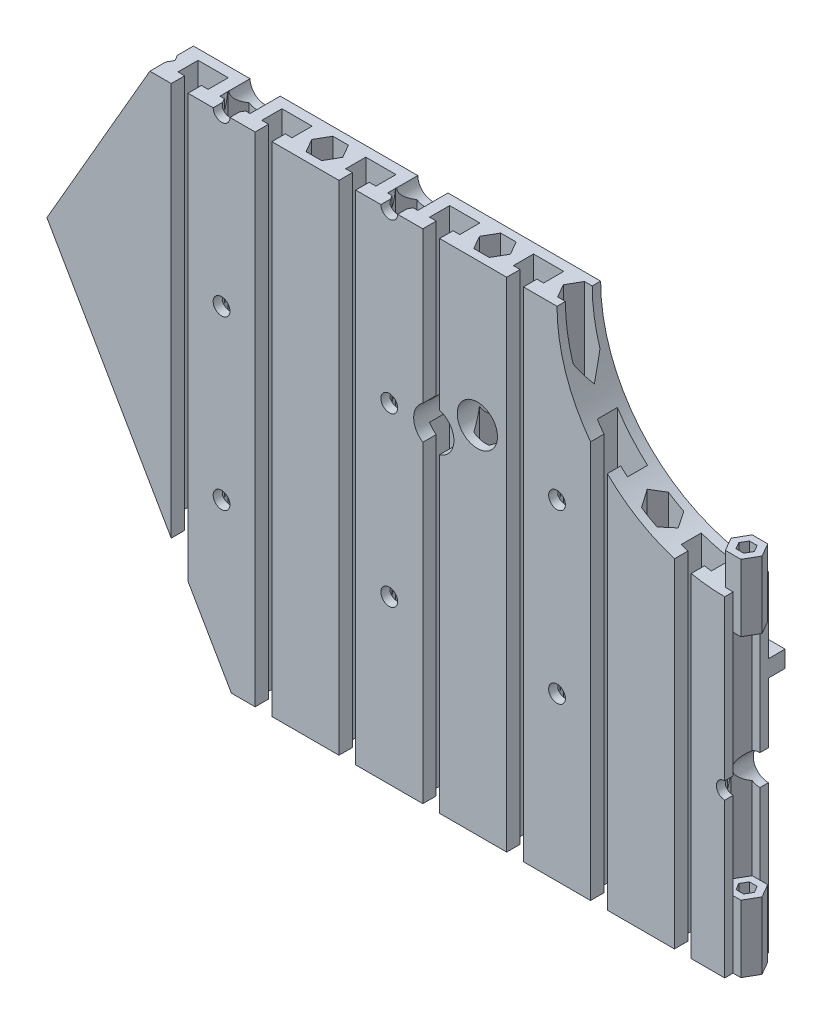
SolidWorks part; units mm, degrees
ref_plane "Plan de face" through (0, 0, 0) normal (0, 0, 1) x (1, 0, 0)
ref_plane "Plan de dessus" through (0, 0, 0) normal (0, 1, 0) x (1, 0, 0)
ref_plane "Plan de droite" through (0, 0, 0) normal (1, 0, 0) x (0, 0, -1)
sketch "Esquisse1" plane through (0, 0, 0) normal (0, 0, 1) x (1, 0, 0)
  line L6 (35.7636, 358.7862) -> (-423.8647, -437.3133) construction
  line L7 (-755.4678, -148.4209) -> (879.7592, -148.4209) construction
  line L8 (-46.1325, 376.7457) -> (415.4529, -422.7436) construction
  line L9 (257.0726, -148.4209) -> (-245.0999, 141.5085) construction
  line L10 (-257.0726, -148.4209) -> (263.2247, 151.9729) construction
  line L11 (-55, 201.5791) -> (55, 201.5791)
  line L12 (-147.0726, -148.4209) -> (147.0726, -148.4209)
  line L13 (147.0726, -148.4209) -> (202.0726, -53.1581)
  line L14 (202.0726, -53.1581) -> (55, 201.5791)
  line L15 (-147.0726, -148.4209) -> (-202.0726, -53.1581)
  line L16 (-202.0726, -53.1581) -> (-55, 201.5791)
  dimension "D1" = 60
  dimension "D2" = 60
  dimension "D3" = 110
  dimension "D4" = 350
  dimension "D5" = 60
  dimension "D6" = 60
  dimension "D7" = 110
  dimension "D8" = 110
extrude "Boss.-Extru.2" add sketch "Esquisse1" along normal blind 13
sketch "Esquisse3" plane through (0, 201.5791, 0) normal (0, 1, 0) x (1, 0, 0)
  line L0 (-12.5, 6.793) -> (-12.5, -19.2478) construction
  line L1 (-8, -3) -> (-17, -3)
  line L2 (-17, -3) -> (-17, -9)
  line L3 (-17, -9) -> (-15, -9)
  line L4 (-15, -9) -> (-15, -13)
  line L5 (55, -13) -> (-55, -13) construction
  line L6 (-10, -9) -> (-10, -13)
  line L7 (-8, -9) -> (-10, -9)
  line L8 (-8, -3) -> (-8, -9)
  line L9 (-15, -13) -> (-10, -13)
  point P2 (-12.5, -13)
  point P14 (-12.5, -3)
  dimension "D1" = 12.5
  dimension "D2" = 9
  dimension "D3" = 5
  dimension "D4" = 6
  dimension "D5" = 4
extrude "Enlèv. mat.-Extru.1" cut sketch "Esquisse3" against normal up to next
pattern_linear "Répétition linéaire1" count 8 spacing 25 along (1, 0, 0) of "Enlèv. mat.-Extru.1"
pattern_linear "Répétition linéaire2" count 7 spacing 25 along (-1, 0, 0) of "Enlèv. mat.-Extru.1"
sketch "certcleRotules" plane through (0, 0, 13) normal (0, 0, 1) x (1, 0, 0)
  circle A0 centre (0, 0) radius 157.5
  dimension "D1" = 315
sketch "Esquisse6" plane through (0, 0, 0) normal (0, 1, 0) x (1, 0, 0)
  line L0 (-157.5, -13) -> (157.5, -13) construction
  line L1 (0, 0) -> (-4.5, 0)
  line L2 (0, 0) -> (0, -13)
  line L3 (-2.5, -9) -> (-4.5, -9)
  line L4 (-4.5, 0) -> (-4.5, -9)
  line L7 (0, -13) -> (-2.5, -13)
  line L8 (-2.5, -9) -> (-2.5, -13)
  dimension "D1" = 4.5
  dimension "D2" = 2.5
  dimension "D3" = 4
revolve "Enlèvement de matière-Révolution1" cut sketch "Esquisse6" angle 360 about L2
pattern_linear "Répétition linéaire3" count 4 spacing 50 along (0, 1, 0) count 4 spacing 50 along (1, 0, 0) of "Enlèvement de matière-Révolution1"
pattern_linear "Répétition linéaire5" count 3 spacing 50 along (0, -1, 0) count 4 spacing 50 along (1, 0, 0) of "Enlèvement de matière-Révolution1"
pattern_linear "Répétition linéaire6" count 4 spacing 50 along (0, 1, 0) count 4 spacing 50 along (-1, 0, 0) of "Enlèvement de matière-Révolution1"
pattern_linear "Répétition linéaire7" count 3 spacing 50 along (0, -1, 0) count 4 spacing 50 along (-1, 0, 0) of "Enlèvement de matière-Révolution1"
sketch "Esquisse8" plane through (0, 0, 0) normal (0, 0, -1) x (-1, 0, 0)
  circle A0 centre (0, 100) radius 4.5 construction
  circle A1 centre (0, 100) radius 4.5
extrude "bouchonBarreauHaut" add sketch "Esquisse8" against normal blind 13
sketch "Esquisse7" plane through (0, 0, 0) normal (0, 0, -1) x (-1, 0, 0)
  line L1 (-6.5, 105.15) -> (6.5, 105.15)
  line L2 (-6.5, 105.15) -> (-6.5, 80.15)
  line L3 (-6.5, 80.15) -> (6.5, 80.15)
  line L4 (6.5, 105.15) -> (6.5, 80.15)
  line L5 (0, 7.15) -> (0, -7.15) construction
  dimension "D1" = 25
  dimension "D2" = 80.15
  dimension "D3" = 13
  dimension "D4" = 6.5
extrude "Boss.-Extru.4" add sketch "Esquisse7" along normal blind 5
sketch "4parties" plane through (0, 0, 0) normal (0, 0, 1) x (1, 0, 0)
  line L0 (-25, 201.5791) -> (-25, 43.3013)
  line L1 (-55, 201.5791) -> (55, 201.5791) construction
  line L2 (-50, 0) -> (-171.3817, 0)
  line L3 (-165, 11.0535) -> (-202.0726, -53.1581) construction
  line L4 (50, 0) -> (171.3817, 0)
  line L5 (202.0726, -53.1581) -> (165, 11.0535) construction
  line L6 (0, -50) -> (0, -148.4209)
  line L7 (-10, -148.4209) -> (10, -148.4209) construction
  circle A0 centre (0, 0) radius 50
  dimension "D1" = 100
  dimension "D2" = 10
sketch "Esquisse9" plane through (0, 0, 0) normal (1, 0, 0) x (0, 0, -1)
  line L0 (5, 80.15) -> (0, 80.15) construction
  line L1 (5, 80.15) -> (5, 105.15) construction
  line L3 (5, 85.15) -> (5, 82.5)
  line L4 (5, 82.5) -> (-3, 82.5)
  line L6 (-3, -148.4209) -> (-3, 201.5791) construction
  line L7 (-13, 157.5) -> (-13, -157.5) construction
  line L8 (-3, 79.15) -> (-13, 79.15)
  line L9 (-3, 79.15) -> (-3, 82.5)
  line L10 (5, 85.15) -> (-13, 85.15)
  line L11 (-13, 79.15) -> (-13, 85.15)
  dimension "D1" = 5
  dimension "D2" = 2.65
  dimension "D3" = 6
revolve "Enlèvement de matière-Révolution2" cut sketch "Esquisse9" angle 360 about L10
pattern_linear "Répétition linéaire8" count 2 spacing 15 along (0, 1, 0) of "Enlèvement de matière-Révolution2"
pattern_circular "Répétition circulaire1" count 3 every 120 about axis through (0, 0, 0) along (0, 0, 1) of "Boss.-Extru.4", "Enlèvement de matière-Révolution2", "Répétition linéaire8"
sketch "Esquisse10" plane through (0, 0, 0) normal (1, 0, 0) x (0, 0, -1)
  line L0 (0, 201.5791) -> (0, -53.1581) construction
  line L1 (0, 77.5) -> (5, 77.5)
  line L2 (0, 77.5) -> (0, 72.5)
  line L3 (0, 72.5) -> (5, 72.5)
  line L4 (5, 77.5) -> (5, 72.5)
  line L5 (0, 50) -> (0, -50) construction
  line L6 (0, -72.5) -> (5, -72.5)
  line L7 (0, -72.5) -> (0, -77.5)
  line L8 (0, -77.5) -> (5, -77.5)
  line L9 (5, -72.5) -> (5, -77.5)
  line L10 (5, 80.15) -> (5, 105.15) construction
  line L11 (-9, 50) -> (0, 50) construction
  line L13 (-9, -100) -> (0, -100) construction
  point P16 (2.5, 72.5)
  point P19 (2.5, -72.5)
  dimension "D1" = 22.5
  dimension "D2" = 5
  dimension "D3" = 22.5
  dimension "D4" = 5
extrude "Boss.-Extru.6" add sketch "Esquisse10" along normal mid plane 250
chamfer "Chanfrein1" distance 5 angle 60 4 edges at (125, -75, -5) (-125, -75, -5) (-125, 75, -5) (125, 75, -5)
sketch "Esquisse11" plane through (0, 0, 13) normal (0, 0, 1) x (1, 0, 0)
  line L0 (-10, -148.4209) -> (-10, 201.5791) construction
  line L1 (-10, 23.5) -> (10, 23.5)
  line L2 (-10, 23.5) -> (-10, -23.5)
  line L3 (-10, -23.5) -> (10, -23.5)
  line L4 (10, 23.5) -> (10, -23.5)
  line L5 (10, -148.4209) -> (10, 201.5791) construction
  dimension "D1" = 47
  dimension "D2" = 23.5
extrude "Enlèv. mat.-Extru.2" cut sketch "Esquisse11" against normal blind 8.9
sketch "Esquisse13" plane through (-8, 0, 0) normal (-1, 0, 0) x (0, 0, 1)
  line L1 (4.1, -23.5) -> (11.1, -23.5)
  line L2 (4.1, -23.5) -> (4.1, -40)
  line L3 (4.1, -40) -> (6.1, -40)
  line L4 (11.1, -23.5) -> (11.1, -35)
  arc A0 (6.1, -40) -> (11.1, -35) centre (6.1, -35) ccw
  dimension "D2" = 5
  dimension "D1" = 16.5
  dimension "D3" = 7
extrude "Enlèv. mat.-Extru.3" cut sketch "Esquisse13" against normal up to surface (16 mm away)
sketch "Esquisse14" plane through (0, 0, 4.1) normal (0, 0, 1) x (1, 0, 0)
  line L0 (-8, 23.5) -> (-8, -40) construction
  line L1 (-3, -20) -> (3, -20)
  line L2 (-8, -25) -> (-8, -35)
  line L3 (-3, -40) -> (3, -40)
  line L4 (8, -25) -> (8, -35)
  line L5 (8, -40) -> (8, 23.5) construction
  line L6 (8, -40) -> (-8, -40) construction
  arc A0 (-8, -35) -> (-3, -40) centre (-3, -35) ccw
  arc A1 (3, -40) -> (8, -35) centre (3, -35) ccw
  arc A2 (3, -20) -> (8, -25) centre (3, -25) cw
  arc A3 (-3, -20) -> (-8, -25) centre (-3, -25) ccw
  point P16 (8, -20)
  point P19 (-8, -20)
  dimension "D3" = 5
  dimension "D1" = 20
extrude "Enlèv. mat.-Extru.4" cut sketch "Esquisse14" against normal up to next
mirror "Symétrie1" about plane through (0, 0, 0) normal (0, 1, 0) of "Enlèv. mat.-Extru.4", "Enlèv. mat.-Extru.3"
sketch "Esquisse15" plane through (0, 0, 0) normal (0, 0, -1) x (-1, 0, 0)
  circle A0 centre (-50, 0) radius 4.5 construction
  circle A1 centre (0, -50) radius 4.5 construction
  circle A2 centre (50, 0) radius 4.5 construction
  circle A3 centre (0, 50) radius 4.5 construction
  circle A4 centre (-50, 0) radius 4.5
  circle A5 centre (0, -50) radius 4.5
  circle A6 centre (50, 0) radius 4.5
  circle A7 centre (0, 50) radius 4.5
extrude "boucheTrousCEntre" add sketch "Esquisse15" against normal up to surface (13 mm away)
sketch "Esquisse16" plane through (0, -148.4209, 0) normal (0, -1, 0) x (1, 0, 0)
  line L0 (0, -9.9) -> (0, 9.9) construction
  line L1 (-2.3094, 2.5) -> (2.3094, 2.5)
  line L2 (2.3094, 2.5) -> (4.6188, 6.5)
  line L3 (4.6188, 6.5) -> (2.3094, 10.5)
  line L4 (2.3094, 10.5) -> (-2.3094, 10.5)
  line L5 (-2.3094, 10.5) -> (-4.6188, 6.5)
  line L6 (-4.6188, 6.5) -> (-2.3094, 2.5)
  line L8 (-10, 13) -> (10, 13) construction
  circle A0 centre (0, 6.5) radius 4 construction
  dimension "D1" = 6.5
  dimension "D2" = 8
extrude "Enlèv. mat.-Extru.5" cut sketch "Esquisse16" against normal through all
pattern_linear "Répétition linéaire9" count 8 spacing 25 along (1, 0, 0) of "Enlèv. mat.-Extru.5"
pattern_linear "Répétition linéaire10" count 8 spacing 25 along (-1, 0, 0) of "Enlèv. mat.-Extru.5"
sketch "Esquisse17" plane through (0, 0, 0) normal (0, 0, -1) x (-1, 0, 0)
  line L0 (50, 0) -> (171.3817, 0) construction
  line L1 (50, 0) -> (171.3817, 0)
  line L2 (0, -50) -> (0, -148.4209) construction
  line L3 (0, -50) -> (0, -148.4209)
  line L6 (202.0726, -53.1581) -> (55, 201.5791)
  line L7 (55, 201.5791) -> (-55, 201.5791)
  line L8 (-55, 201.5791) -> (-202.0726, -53.1581)
  line L9 (-202.0726, -53.1581) -> (-147.0726, -148.4209)
  line L10 (-147.0726, -148.4209) -> (147.0726, -148.4209)
  line L11 (147.0726, -148.4209) -> (202.0726, -53.1581)
  line L12 (171.3817, 0) -> (55, 201.5791)
  line L13 (55, 201.5791) -> (-55, 201.5791)
  line L14 (-55, 201.5791) -> (-202.0726, -53.1581)
  line L15 (-202.0726, -53.1581) -> (-147.0726, -148.4209)
  line L16 (-147.0726, -148.4209) -> (0, -148.4209)
  circle A0 centre (0, 0) radius 50 construction
  arc A1 (0, -50) -> (50, 0) centre (0, 0) ccw
  dimension "D1" = 0
extrude "Enlèv. mat.-Extru.6" cut sketch "Esquisse17" against normal through all both and the other way through all
sketch "Esquisse20" plane through (0, -148.4209, 0) normal (0, -1, 0) x (1, 0, 0)
  line L0 (0, 9) -> (0, 6.7058) construction
  line L1 (-4.6188, 6.5) -> (-2.3094, 2.5)
  line L2 (-2.3094, 2.5) -> (2.3094, 2.5)
  line L3 (2.3094, 2.5) -> (4.6188, 6.5)
  line L4 (4.6188, 6.5) -> (2.3094, 10.5)
  line L5 (2.3094, 10.5) -> (-2.3094, 10.5)
  line L6 (-2.3094, 10.5) -> (-4.6188, 6.5)
  line L7 (-2.3094, 10.5) -> (-4.6188, 6.5) construction
  line L8 (-4.6188, 6.5) -> (-2.3094, 2.5) construction
  line L10 (1.1547, 4.5) -> (2.3094, 6.5)
  line L11 (2.3094, 6.5) -> (1.1547, 8.5)
  line L12 (1.1547, 8.5) -> (-1.1547, 8.5)
  line L13 (-1.1547, 8.5) -> (-2.3094, 6.5)
  line L14 (-2.3094, 6.5) -> (-1.1547, 4.5)
  line L15 (-1.1547, 4.5) -> (1.1547, 4.5)
  circle A0 centre (0, 6.5) radius 4 construction
  circle A1 centre (0, 6.5) radius 2 construction
  dimension "D1" = 2
extrude "Boss.-Extru.7" add sketch "Esquisse20" against normal blind 20
pattern_linear "Répétition linéaire11" count 2 spacing 88 along (0, 1, 0) of "Boss.-Extru.7"
